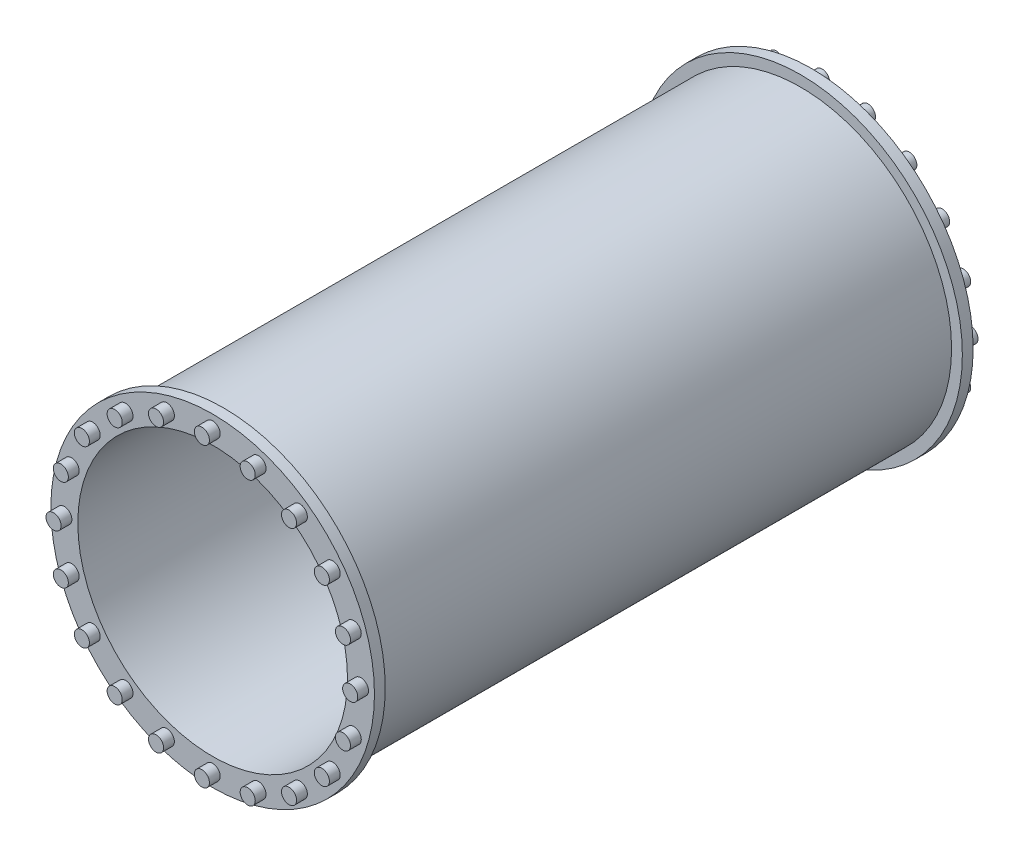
SolidWorks part; units mm, degrees
ref_plane "Front Plane" through (0, 0, 0) normal (0, 0, 1) x (1, 0, 0)
ref_plane "Top Plane" through (0, 0, 0) normal (0, 1, 0) x (1, 0, 0)
ref_plane "Right Plane" through (0, 0, 0) normal (1, 0, 0) x (0, 0, -1)
sketch "Sketch1" plane through (0, 0, 0) normal (0, 0, 1) x (1, 0, 0)
  circle A0 centre (0, 0) radius 125
  circle A1 centre (0, 0) radius 150
  dimension "D1" = 250
  dimension "D2" = 300
extrude "Boss-Extrude1" add sketch "Sketch1" along normal blind 10
sketch "Sketch2" plane through (0, 0, 10) normal (0, 0, 1) x (1, 0, 0)
  circle A1 centre (0, 137.5) radius 7
  dimension "D1" = 137.5
extrude "Boss-Extrude2" add sketch "Sketch2" along normal blind 10
pattern_circular "CirPattern1" count 20 over 360 about axis through (0, 0, 0) along (0, 0, 1) of "Boss-Extrude2"
sketch "Sketch3" plane through (0, 0, 0) normal (0, 0, -1) x (-1, 0, 0)
  circle A0 centre (0, 0) radius 125
  circle A1 centre (0, 0) radius 140
extrude "Boss-Extrude3" add sketch "Sketch3" along normal blind 535
sketch "Sketch4" plane through (0, 0, -535) normal (0, 0, -1) x (-1, 0, 0)
  circle A0 centre (0, 0) radius 125
  circle A1 centre (0, 0) radius 150
extrude "Boss-Extrude4" add sketch "Sketch4" along normal blind 10
sketch "Sketch5" plane through (0, 0, -545) normal (0, 0, -1) x (-1, 0, 0)
  circle A1 centre (0, 137.5) radius 7
  dimension "D1" = 137.5
extrude "Boss-Extrude5" add sketch "Sketch5" along normal blind 10
pattern_circular "CirPattern2" count 20 over 360 about axis through (0, 0, 0) along (0, 0, 1) of "Boss-Extrude5"
